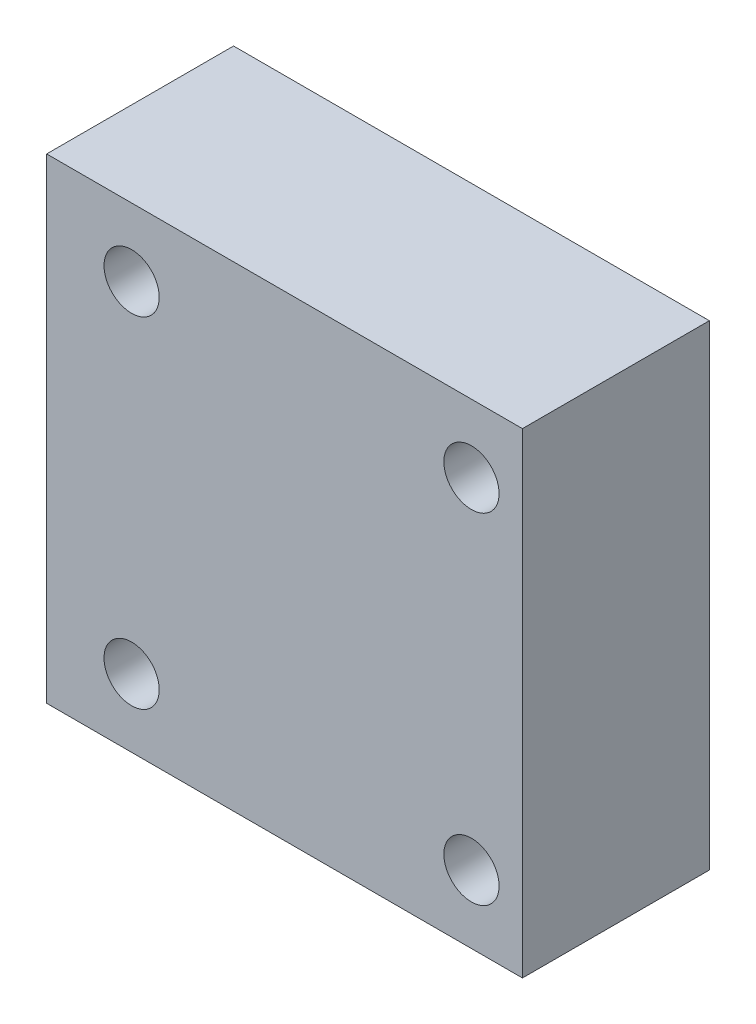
SolidWorks part; units mm, degrees
ref_plane "前视基准面" through (0, 0, 0) normal (0, 0, 1) x (1, 0, 0)
ref_plane "上视基准面" through (0, 0, 0) normal (0, 1, 0) x (1, 0, 0)
ref_plane "右视基准面" through (0, 0, 0) normal (1, 0, 0) x (0, 0, -1)
sketch "草图1" plane through (0, 0, 0) normal (0, 0, 1) x (1, 0, 0)
  line L0 (56, -56) -> (56, 0)
  line L1 (0, -56) -> (0, 0)
  line L2 (0, 0) -> (56, 0)
  line L3 (0, -56) -> (56, -56)
  circle A0 centre (10, -8) radius 3.25
  circle A1 centre (50, -8) radius 3.25
  circle A2 centre (50, -48) radius 3.25
  circle A3 centre (10, -48) radius 3.25
extrude "凸台-拉伸1" add sketch "草图1" along normal blind 22
